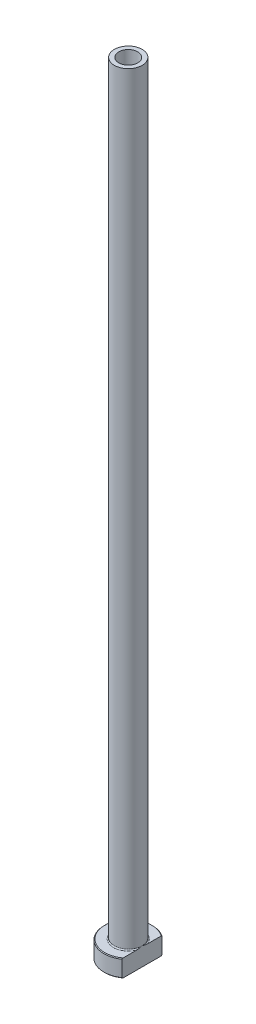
SolidWorks part; units mm, degrees
ref_plane "Front Plane" through (0, 0, 0) normal (0, 0, 1) x (1, 0, 0)
ref_plane "Top Plane" through (0, 0, 0) normal (0, 1, 0) x (1, 0, 0)
ref_plane "Right Plane" through (0, 0, 0) normal (1, 0, 0) x (0, 0, -1)
sketch "Sketch1" plane through (0, 0, 0) normal (0, 0, 1) x (1, 0, 0)
  line L0 (-2.75, 225) -> (-4, 225)
  line L1 (-4, 225) -> (-4, 5)
  line L2 (-4, 5) -> (-7, 5)
  line L3 (-7, 5) -> (-7, 0)
  line L4 (6.05, 0) -> (-6.05, 0) construction
  line L5 (-7, 0) -> (-3, 0)
  line L6 (-2.75, 180) -> (-2.75, 225)
  line L7 (0, 92.1877) -> (0, -15.5353) construction
  line L8 (0, -7.7) -> (0, 7.7) construction
  line L9 (-2.75, 180) -> (-3, 168)
  line L10 (-3, 168) -> (-3, 0)
  dimension "D1" = 0.25
  dimension "ID" = 5.5
  dimension "OD" = 8
  dimension "L" = 225
  dimension "H" = 14
  dimension "T" = 5
  dimension "N" = 45
  dimension "D2" = 12
  dimension "L-N" = 180
revolve "Revolve1" add sketch "Sketch1" angle 360 about L7
fillet "Fillet1" radius 0.3 1 edges at (0, 5, 4)
chamfer "Chamfer1" distance 0.2 angle 45 2 edges at (0, 5, 7) (0, 0, 7)
sketch "Sketch2" plane through (0, 0, 0) normal (0, -1, 0) x (1, 0, 0)
  line L0 (4, 5.7446) -> (4, -5.7446)
  circle A0 centre (0, 0) radius 7 construction
  arc A1 (4, 5.7446) -> (4, -5.7446) centre (0, 0) cw
  circle A2 centre (0, 0) radius 4 construction
extrude "Cut-Extrude1" cut sketch "Sketch2" against normal through all
chamfer "Chamfer2" distance 0.5 angle 45 1 edges at (0, 0, 3)
